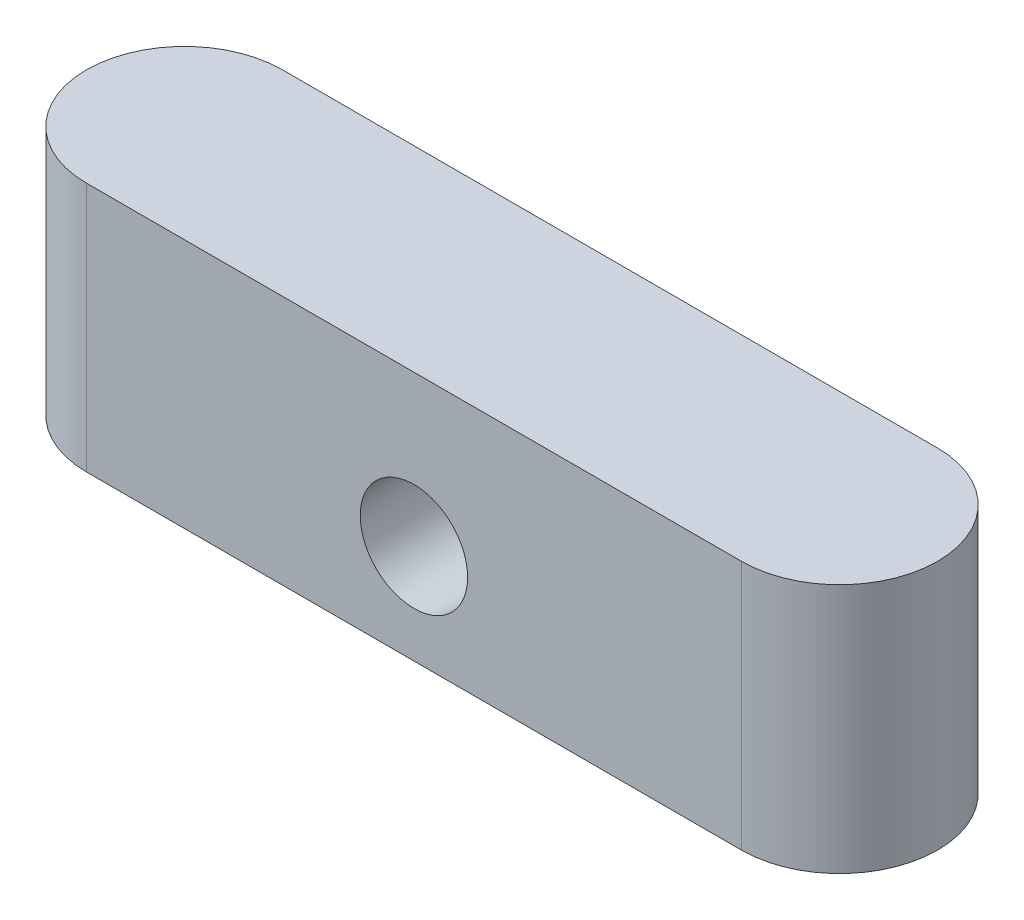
SolidWorks part; units mm, degrees
ref_plane "Front Plane" through (0, 0, 0) normal (0, 0, 1) x (1, 0, 0)
ref_plane "Top Plane" through (0, 0, 0) normal (0, 1, 0) x (1, 0, 0)
ref_plane "Right Plane" through (0, 0, 0) normal (1, 0, 0) x (0, 0, -1)
sketch "Sketch1" plane through (0, 0, 0) normal (0, 1, 0) x (1, 0, 0)
  line L0 (-8.25, 0) -> (8.25, 0) construction
  line L1 (-8.25, 2.4701) -> (8.25, 2.4702)
  line L2 (-8.25, -2.4701) -> (8.25, -2.4701)
  arc A0 (-8.25, 2.4701) -> (-8.25, -2.4701) centre (-8.25, 0) ccw
  arc A1 (8.25, -2.4701) -> (8.25, 2.4702) centre (8.25, 0) ccw
  point P2 (0, 0)
  dimension "D1" = 16.5
  dimension "D2" = 4.9403
extrude "Boss-Extrude1" add sketch "Sketch1" along normal mid plane 6.3
hole_wizard "#6-32 Tapped Hole1" positions "Sketch3" profile "Sketch2" tap size "#6-32" standard "ANSI Inch"
sketch "Sketch3" plane through (0, 0, 2.4701) normal (0, 0, 1) x (1, 0, 0)
  line L0 (-8.25, -3.15) -> (8.25, -3.15) construction
  point P0 (0, -0.65)
  dimension "D1" = 2.5
sketch "Sketch2" plane through (0, -0.65, 2.4701) normal (1, 0, 0) x (0, -1, 0)
  line L0 (0, 0) -> (0, 4.9403)
  line L1 (0, 4.9403) -> (1.3525, 4.9403)
  line L2 (1.3525, 4.9403) -> (1.3525, 0)
  line L5 (1.3525, 0) -> (0, 0)
  line L11 (0, -6.35) -> (0, 107.95) construction
  dimension "Thru Tap Drill Dia." = 2.7051
  dimension "Thru Tap Drill Depth" = 4.9403
